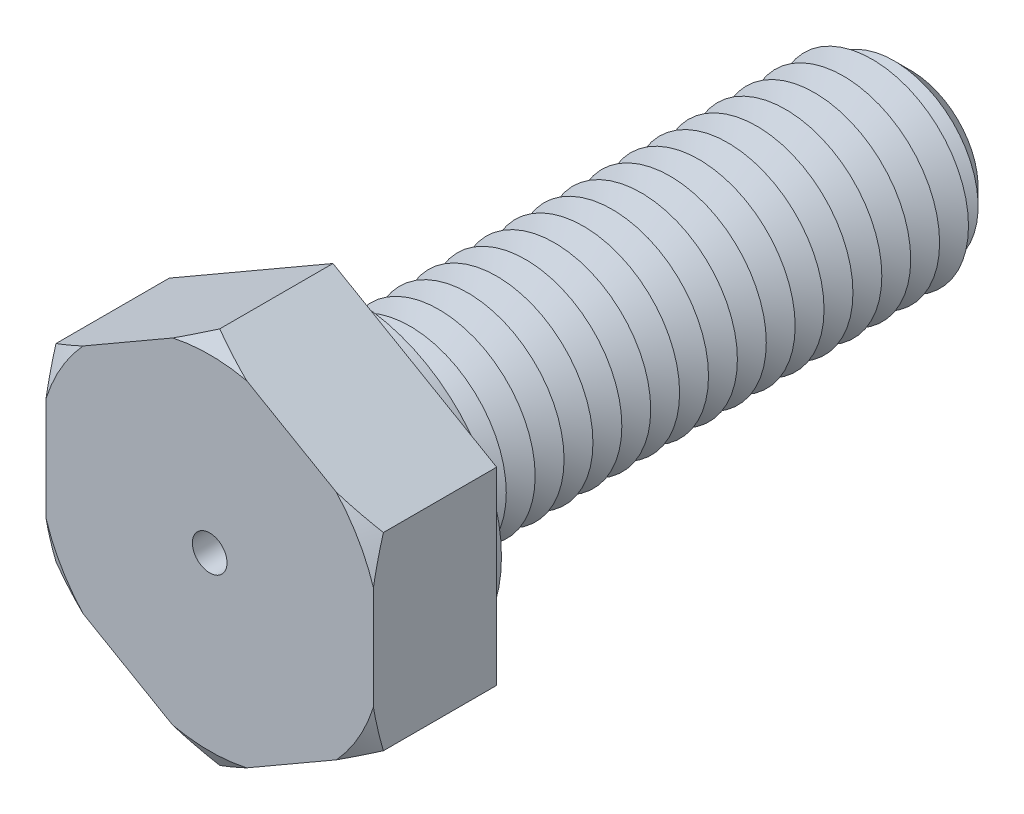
SolidWorks part; units mm, degrees
ref_plane "Front Plane" through (0, 0, 0) normal (0, 0, 1) x (1, 0, 0)
ref_plane "Top Plane" through (0, 0, 0) normal (0, 1, 0) x (1, 0, 0)
ref_plane "Right Plane" through (0, 0, 0) normal (1, 0, 0) x (0, 0, -1)
sketch "Sketch2" plane through (0, 0, 0) normal (0, 0, 1) x (1, 0, 0)
  line L1 (0, 9.815) -> (-8.5, 4.9075)
  line L2 (-8.5, 4.9075) -> (-8.5, -4.9075)
  line L3 (-8.5, -4.9075) -> (0, -9.815)
  line L4 (0, -9.815) -> (8.5, -4.9075)
  line L5 (8.5, -4.9075) -> (8.5, 4.9075)
  line L6 (8.5, 4.9075) -> (0, 9.815)
  circle A0 centre (0, 0) radius 8.5 construction
  dimension "D1" = 17
extrude "Boss-Extrude1" add sketch "Sketch2" along normal blind 6.4
sketch "Sketch3" plane through (0, 0, 0) normal (0, 0, -1) x (-1, 0, 0)
  circle A0 centre (0, 0) radius 5
  dimension "D1" = 10
extrude "Boss-Extrude2" add sketch "Sketch3" along normal blind 30
sketch "Sketch4" plane through (0, 0, 0) normal (0, 0, -1) x (-1, 0, 0)
  circle A0 centre (0, 0) radius 7.75
  dimension "D1" = 15.5
extrude "Boss-Extrude3" add sketch "Sketch4" along normal blind 1
sketch "Sketch5" plane through (0, 0, 0) normal (1, 0, 0) x (0, 0, -1)
  line L0 (-3.2117, 0) -> (6.3192, 0) construction
chamfer "Chamfer1" distance 1.5 angle 45 1 edges at (-5, 0, -30)
sketch "Sketch6" plane through (0, 0, 0) normal (1, 0, 0) x (0, 0, -1)
  line L0 (1, 5) -> (1.75, 3.701)
  line L1 (1.75, 3.701) -> (2.5, 5)
  line L2 (28.5, 5) -> (1, 5) construction
  line L3 (2.5, 5) -> (1, 5)
  dimension "D1" = 1.5
revolve "Cut-Revolve1" cut sketch "Sketch6" angle 360 about L0
pattern_linear "LPattern1" count 19 spacing 1.5 along (0, 0, -1) of "Cut-Revolve1"
sketch "Sketch7" plane through (0, 0, 0) normal (1, 0, 0) x (0, 0, -1)
  line L0 (-6.4, 9.815) -> (-6.4, 8.915)
  line L1 (-6.4, 4.9075) -> (-6.4, 9.815) construction
  line L2 (-6.4, 8.915) -> (-5.8804, 9.815)
  line L3 (-6.4, 9.815) -> (0, 9.815) construction
  line L4 (-5.8804, 9.815) -> (-6.4, 9.815)
  dimension "D1" = 0.9
  dimension "D2" = 30
revolve "Cut-Revolve2" cut sketch "Sketch7" angle 360 about L0
sketch "Sketch8" plane through (0, 0, 6.4) normal (0, 0, 1) x (1, 0, 0)
  circle A0 centre (0, 0) radius 0.9
  dimension "D1" = 1.8
extrude "Cut-Extrude1" cut sketch "Sketch8" against normal up to surface (36.4 mm away)
